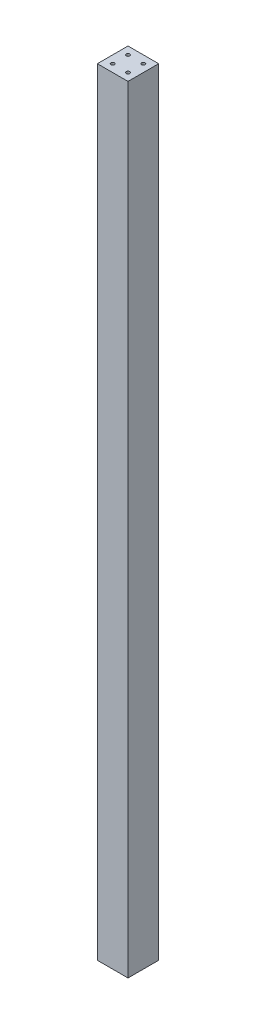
SolidWorks part; units mm, degrees
ref_plane "前视基准面" through (0, 0, 0) normal (0, 0, 1) x (1, 0, 0)
ref_plane "上视基准面" through (0, 0, 0) normal (0, 1, 0) x (1, 0, 0)
ref_plane "右视基准面" through (0, 0, 0) normal (1, 0, 0) x (0, 0, -1)
other "Configuration Table"
sketch "草图1" plane through (0, 0, 0) normal (0, 1, 0) x (1, 0, 0)
  line L1 (-30, 30) -> (30, 30)
  line L2 (-30, 30) -> (-30, -30)
  line L3 (-30, -30) -> (30, -30)
  line L4 (30, 30) -> (30, -30)
  line L5 (-30, 30) -> (30, -30) construction
  line L6 (-30, -30) -> (30, 30) construction
  point P0 (0, 0)
extrude "凸台-拉伸1" add sketch "草图1" along normal blind 1520
sketch "草图2" plane through (0, 0, 30) normal (0, 0, 1) x (1, 0, 0)
  line L0 (-30, 60) -> (30, 60)
  line L1 (-30, 1520) -> (-30, 0) construction
  line L2 (30, 1520) -> (30, 0) construction
  line L3 (-30, 0) -> (30, 0) construction
  line L4 (-30, 1460) -> (30, 1460)
  line L5 (-30, 1520) -> (30, 1520) construction
  dimension "D1" = 60
  dimension "D2" = 60
sketch "草图4" plane through (0, 0, 30) normal (0, 0, 1) x (1, 0, 0)
  line L0 (0, 1460) -> (0, 60)
  line L1 (-30, 1460) -> (30, 1460) construction
  line L2 (-30, 60) -> (30, 60) construction
sketch "草图5" plane through (0, 0, 0) normal (0, -1, 0) x (1, 0, 0)
  line L0 (30, 30) -> (30, -30) construction
  line L1 (30, -30) -> (-30, -30) construction
  point P0 (15, -15)
  dimension "D1" = 15
  dimension "D2" = 15
hole_wizard "M8 螺纹孔1" positions "草图6" profile "草图7" tap size "M8" standard "GB"
sketch "草图6" plane through (0, 0, 0) normal (0, -1, 0) x (-1, 0, 0)
  point P0 (-15, 15)
sketch "草图7" plane through (15, 0, -15) normal (1, 0, 0) x (0, 0, -1)
  line L0 (0, 0) -> (0, 19.75)
  line L1 (0, 19.75) -> (3.4, 17.7071)
  line L2 (3.4, 17.7071) -> (3.4, 0)
  line L5 (3.4, 0) -> (0, 0)
  line L10 (0, 19.75) -> (-3.4, 17.7071) construction
  line L11 (0, -6.35) -> (0, 107.95) construction
  dimension "螺纹孔钻头直径" = 6.8
  dimension "螺纹孔钻头深度" = 19.75
  dimension "导头角度" = 118
pattern_linear "阵列(线性)1" count 2 spacing 30 along (-1, 0, 0) count 2 spacing 30 along (0, 0, 1) of "M8 螺纹孔1"
hole_wizard "M8 螺纹孔2" positions "草图9" profile "草图10" tap size "M8" standard "GB"
sketch "草图9" plane through (0, 1520, 0) normal (0, 1, 0) x (1, 0, 0)
  point P0 (15, 15)
sketch "草图10" plane through (15, 1520, -15) normal (1, 0, 0) x (0, 0, 1)
  line L0 (0, 0) -> (0, 19.75)
  line L1 (0, 19.75) -> (3.4, 17.7071)
  line L2 (3.4, 17.7071) -> (3.4, 0)
  line L5 (3.4, 0) -> (0, 0)
  line L10 (0, 19.75) -> (-3.4, 17.7071) construction
  line L11 (0, -6.35) -> (0, 107.95) construction
  dimension "螺纹孔钻头直径" = 6.8
  dimension "螺纹孔钻头深度" = 19.75
  dimension "导头角度" = 118
pattern_linear "阵列(线性)2" count 2 spacing 30 along (-1, 0, 0) count 2 spacing 30 along (0, 0, 1) of "M8 螺纹孔2"
sketch "草图11" plane through (0, 0, 30) normal (0, 0, 1) x (1, 0, 0)
  line L0 (30, 1520) -> (30, 0) construction
  line L1 (-30, 0) -> (30, 0) construction
  line L2 (-30, 1520) -> (-30, 0) construction
  line L3 (-30, 1520) -> (30, 1520) construction
  point P0 (15, 290)
  point P5 (-15, 290)
  point P8 (15, 1230)
  point P9 (-15, 1230)
  dimension "D1" = 15
  dimension "D2" = 290
  dimension "D3" = 15
  dimension "D4" = 290
  dimension "D5" = 290
sketch "草图14" plane through (0, 0, 30) normal (0, 0, 1) x (1, 0, 0)
  line L0 (-30, 0) -> (30, 0) construction
  line L1 (-30, 1520) -> (30, 1520) construction
  line L3 (-30, 1520) -> (-30, 0) construction
  point P0 (-15, 315)
  point P1 (-15, 345)
  point P2 (-15, 1205)
  point P3 (-15, 1175)
  dimension "D1" = 345
  dimension "D2" = 15
  dimension "D3" = 345
  dimension "D4" = 15
  dimension "D5" = 30
  dimension "D6" = 15
  dimension "D7" = 15
  dimension "D8" = 30
